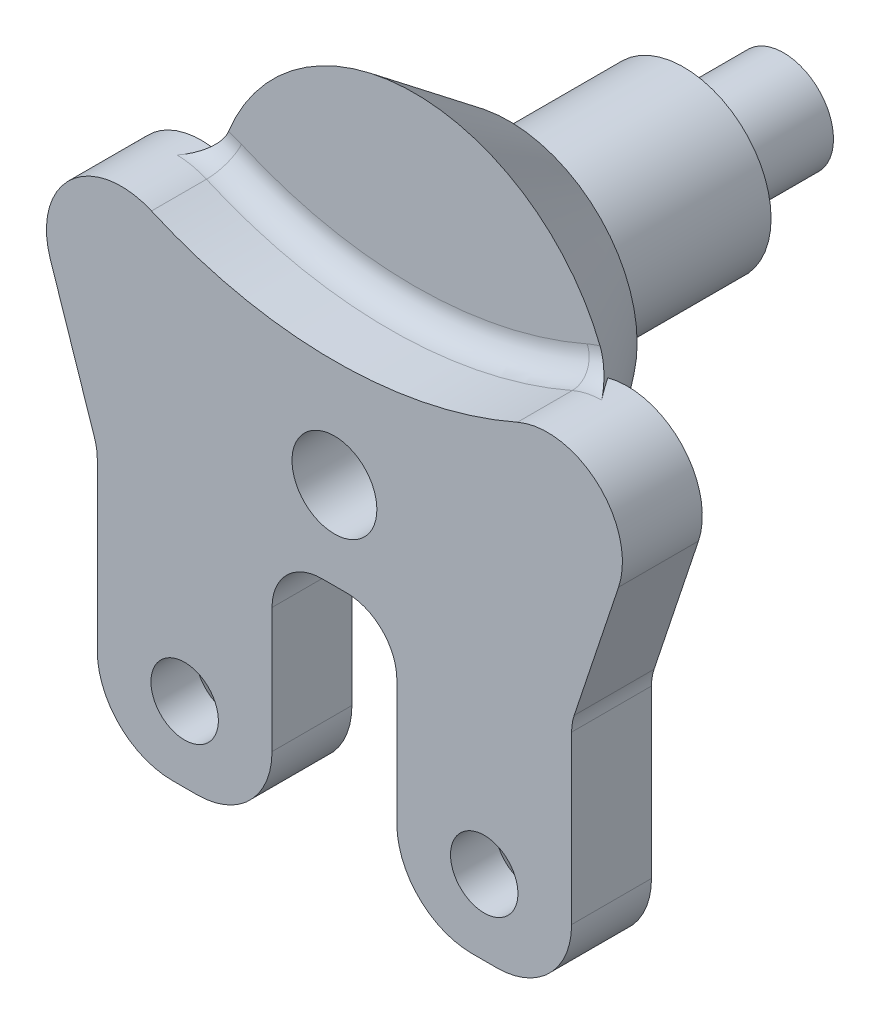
SolidWorks part; units mm, degrees
ref_plane "Plano frontal" through (0, 0, 0) normal (0, 0, 1) x (1, 0, 0)
ref_plane "Plano superior" through (0, 0, 0) normal (0, 1, 0) x (1, 0, 0)
ref_plane "Plano direito" through (0, 0, 0) normal (1, 0, 0) x (0, 0, -1)
sketch "Esboço2" plane through (0, 0, 0) normal (0, 0, 1) x (1, 0, 0)
  line L0 (0, 1.5) -> (0, 38.5) construction
  line L1 (0, 0) -> (-9.432, 0) construction
  line L2 (0.5, -7.5) -> (-0.5, -7.5)
  line L3 (14.5, -7.5) -> (9.5, -7.5) construction
  line L4 (14.5, -7.5) -> (14.5, 7.5) construction
  line L6 (-14.5, -7.5) -> (-14.5, 7.5) construction
  line L7 (14.5, -7.5) -> (-14.5, 7.5) construction
  line L8 (14.5, 7.5) -> (-14.5, -7.5) construction
  line L10 (9.5, -7.8246) -> (9.5, -14.5)
  line L11 (6.5, -17.5) -> (5.5, -17.5)
  line L12 (2.5, -9.5) -> (2.5, -14.5)
  line L14 (-2.5, -9.5) -> (-2.5, -14.5)
  line L15 (-5.5, -17.5) -> (-6.5, -17.5)
  line L16 (-9.5, -7.8246) -> (-9.5, -14.5)
  line L17 (-9.5, -7.5) -> (-14.5, -7.5) construction
  line L18 (-11.3818, -1.8547) -> (-9.6026, -7.1921)
  line L19 (11.3818, -1.8547) -> (9.6026, -7.1921)
  arc A1 (7.3279, 1.8401) -> (-7.3279, 1.8401) centre (0, 18.5) cw
  arc A3 (11.3818, -1.8547) -> (7.3279, 1.8401) centre (8.5357, -0.906) ccw
  arc A4 (-7.3279, 1.8401) -> (-11.3818, -1.8547) centre (-8.5357, -0.906) ccw
  arc A5 (9.5, -14.5) -> (6.5, -17.5) centre (6.5, -14.5) cw
  arc A6 (5.5, -17.5) -> (2.5, -14.5) centre (5.5, -14.5) cw
  arc A7 (-2.5, -14.5) -> (-5.5, -17.5) centre (-5.5, -14.5) cw
  arc A8 (-6.5, -17.5) -> (-9.5, -14.5) centre (-6.5, -14.5) cw
  arc A9 (9.6026, -7.1921) -> (9.5, -7.8246) centre (11.5, -7.8246) ccw
  arc A10 (0.5, -7.5) -> (2.5, -9.5) centre (0.5, -9.5) cw
  arc A11 (-0.5, -7.5) -> (-2.5, -9.5) centre (-0.5, -9.5) ccw
  arc A12 (-9.6026, -7.1921) -> (-9.5, -7.8246) centre (-11.5, -7.8246) cw
  point P5 (0, 0)
  point P9 (0, 0)
  point P33 (9.5, -17.5)
  point P36 (2.5, -17.5)
  point P39 (-2.5, -17.5)
  point P42 (-9.5, -17.5)
  point P48 (2.5, -7.5)
  point P51 (-2.5, -7.5)
  dimension "D6" = 15
  dimension "D3" = 5
  dimension "D9" = 3
  dimension "D10" = 2
  dimension "D12" = 18.2003
  dimension "D1" = 7
  dimension "D2" = 7
  dimension "D4" = 10
  dimension "D5" = 10
  dimension "D7" = 5
  dimension "D8" = 5
  dimension "D11" = 7.5
extrude "Ressalto-extrusão1" add sketch "Esboço2" along normal blind 3.2
sketch "Esboço3" plane through (0, 0, 0) normal (0, 1, 0) x (1, 0, 0)
  line L0 (0, 0) -> (0, 4.2827) construction
  line L3 (0, 0) -> (8, 0)
  line L4 (7.3279, 0) -> (-7.3279, 0) construction
  line L5 (11.5357, 0) -> (7.3279, 0) construction
  line L6 (8, 0) -> (5.135, 3.79)
  line L7 (5.135, 3.79) -> (3.5, 3.79)
  line L8 (3.5, 3.79) -> (3.5, 10.79)
  line L9 (3.5, 10.79) -> (2, 10.79)
  line L10 (2, 10.79) -> (2, 14.79)
  line L11 (2, 14.79) -> (0, 14.79)
  line L12 (0, 0) -> (0, 14.79)
  point P4 (0, 0)
  dimension "D1" = 8
  dimension "D2" = 3.5
  dimension "D3" = 5.135
  dimension "D4" = 3.79
  dimension "D5" = 7
  dimension "D6" = 2
  dimension "D7" = 4
revolve "Revolução1" add sketch "Esboço3" angle 360 about L0
sketch "Esboço4" plane through (0, 0, 0) normal (0, 0, -1) x (-1, 0, 0)
  line L0 (-2.5, -14.5) -> (-9.5, -14.5) construction
  line L1 (2.5, -14.5) -> (9.5, -14.5) construction
  point P8 (6, -14.5)
  point P10 (-6, -14.5)
ref_point "Ponto1"
ref_point "Ponto2"
fillet "Filete3" radius 1 3 edges at (7.5356, 1.9224, 0) (-7.5356, 1.9224, 0) (0, 0.2997, 0)
hole_wizard "Escareado para parafuso de máquina com cabeça chata de M31" positions "3DSketch4" profile "Esboço8" countersink size "M3" standard "Ansi Metric"
sketch3d "3DSketch4"
  point P0 (9.7751, -5.7099, 52.8)
  point P3 (0, 0, 0)
  point P4 (9.7751, -4.6142, 52.8)
  point P5 (9.7751, -5.5174, 52.8)
  point P6 (0, 0, 0)
  point P7 (9.7751, -4.3792, 52.8)
  point P8 (9.7751, -4.2426, 52.8)
  point P9 (0, 0, 0)
  point P10 (9.7751, -5.3106, 52.8)
sketch "Esboço8" plane through (0, -4, 6.4) normal (1, 0, 0) x (0, 1, 0)
  line L0 (0, 0) -> (0, 9.0215)
  line L1 (0, 9.0215) -> (1.7, 8)
  line L2 (1.7, 8) -> (1.7, 1.45)
  line L3 (1.7, 1.45) -> (3.15, 0)
  line L4 (3.15, 0) -> (0, 0)
  line L5 (-1.7, 1.45) -> (-3.15, 0) construction
  line L6 (0, 9.0215) -> (-1.7, 8) construction
  line L7 (0, -6.35) -> (0, 107.95) construction
  dimension "Hole Dia." = 3.4
  dimension "Hole Depth" = 8
  dimension "Near C'Sink Dia." = 6.3
  dimension "Near C'Sink Angle" = 90
  dimension "Drill Angle" = 118
sketch "Esboço10" plane through (0, 0, 3.2) normal (0, 0, 1) x (1, 0, 0)
  circle A0 centre (0, -4) radius 1.7
  dimension "D1" = 3.4
extrude "Corte-extrusão1" cut sketch "Esboço10" against normal blind 4
hole_wizard "Escareado para parafuso de máquina com cabeça chata de M2.51" positions "3DSketch7" profile "Esboço15" countersink size "M2.5" standard "Ansi Metric"
sketch3d "3DSketch7"
  point P0 (6, -14.5, 0)
  point P3 (-6, -14.5, 0)
sketch "Esboço15" plane through (6, -14.5, 0) normal (1, 0, 0) x (0, 1, 0)
  line L0 (0, 0) -> (0, 3.2)
  line L1 (0, 3.2) -> (1.35, 3.2)
  line L2 (1.35, 3.2) -> (1.35, 1.4)
  line L3 (1.35, 1.4) -> (2.75, 0)
  line L5 (2.75, 0) -> (0, 0)
  line L6 (-1.35, 1.4) -> (-2.75, 0) construction
  line L11 (0, -6.35) -> (0, 107.95) construction
  dimension "Thru Hole Dia." = 2.7
  dimension "Thru Hole Depth" = 3.2
  dimension "Near C'Sink Dia." = 5.5
  dimension "Near C'Sink Angle" = 90
